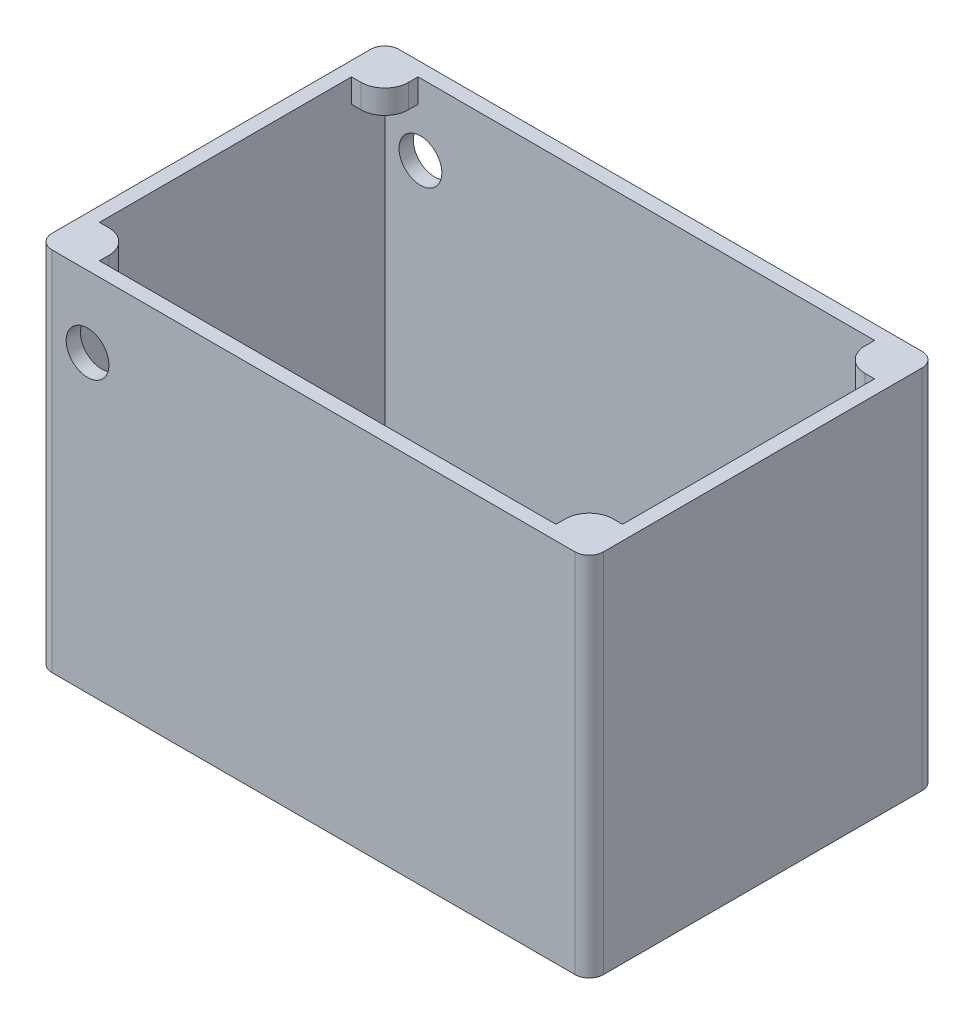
SolidWorks part; units mm, degrees
ref_plane "Front" through (0, 0, 0) normal (0, 0, 1) x (1, 0, 0)
ref_plane "Top" through (0, 0, 0) normal (0, 1, 0) x (1, 0, 0)
ref_plane "Right" through (0, 0, 0) normal (1, 0, 0) x (0, 0, -1)
sketch "Sketch1" plane through (0, 0, 0) normal (0, 1, 0) x (1, 0, 0)
  line L1 (-58, -36.5) -> (58, -36.5)
  line L2 (-58, -36.5) -> (-58, 36.5)
  line L3 (-58, 36.5) -> (58, 36.5)
  line L4 (58, -36.5) -> (58, 36.5)
  line L5 (-58, -36.5) -> (58, 36.5) construction
  line L6 (-58, 36.5) -> (58, -36.5) construction
  point P0 (0, 0)
extrude "Boss-Extrude1" add sketch "Sketch1" along normal blind 77
sketch "Sketch2" plane through (0, 77, 0) normal (0, 1, 0) x (1, 0, 0)
  line L0 (-55, 33.5) -> (-55, 36.5) construction
  line L1 (-55, -33.5) -> (55, -33.5)
  line L2 (-55, -33.5) -> (-55, 33.5)
  line L3 (-55, 33.5) -> (55, 33.5)
  line L4 (55, -33.5) -> (55, 33.5)
  line L5 (-55, -33.5) -> (55, 33.5) construction
  line L6 (-55, 33.5) -> (55, -33.5) construction
  line L7 (58, 36.5) -> (-58, 36.5) construction
  line L8 (-55, 36.5) -> (-58, 36.5) construction
  point P0 (0, 0)
  dimension "D1" = 3
  dimension "D2" = 3
extrude "Cut-Extrude3" cut sketch "Sketch2" against normal blind 73.5
sketch "Sketch11" plane through (0, 0, 33.5) normal (0, 0, -1) x (-1, 0, 0)
  circle A0 centre (47.5, 62) radius 4.5
  point P0 (0, 0)
extrude "Cut-Extrude6" cut sketch "Sketch11" against normal through all both and the other way through all
sketch "Sketch12" plane through (0, 77, 0) normal (0, 1, 0) x (1, 0, 0)
  line L1 (58, 36.5) -> (48, 36.5)
  line L2 (58, 36.5) -> (58, 26.5)
  line L3 (58, 26.5) -> (48, 26.5)
  line L4 (48, 36.5) -> (48, 26.5)
  line L5 (58, -36.5) -> (48, -36.5)
  line L6 (58, -36.5) -> (58, -26.5)
  line L7 (58, -26.5) -> (48, -26.5)
  line L8 (48, -36.5) -> (48, -26.5)
  line L9 (-58, 36.5) -> (-48, 36.5)
  line L10 (-58, 36.5) -> (-58, 26.5)
  line L11 (-58, 26.5) -> (-48, 26.5)
  line L12 (-48, 36.5) -> (-48, 26.5)
  line L13 (-58, -36.5) -> (-48, -36.5)
  line L14 (-58, -36.5) -> (-58, -26.5)
  line L15 (-58, -26.5) -> (-48, -26.5)
  line L16 (-48, -36.5) -> (-48, -26.5)
extrude "Boss-Extrude5" add sketch "Sketch12" against normal blind 5
fillet "Fillet1" radius 3 1 edges at (-58, 38.5, -36.5)
fillet "Fillet2" radius 3 1 edges at (-58, 38.5, 36.5)
fillet "Fillet3" radius 3 1 edges at (58, 38.5, 36.5)
fillet "Fillet4" radius 3 1 edges at (58, 38.5, -36.5)
fillet "Fillet5" radius 5 1 edges at (-48, 74.5, -26.5)
fillet "Fillet6" radius 5 1 edges at (-48, 74.5, 26.5)
fillet "Fillet7" radius 5 1 edges at (48, 74.5, -26.5)
fillet "Fillet8" radius 5 1 edges at (48, 74.5, 26.5)
